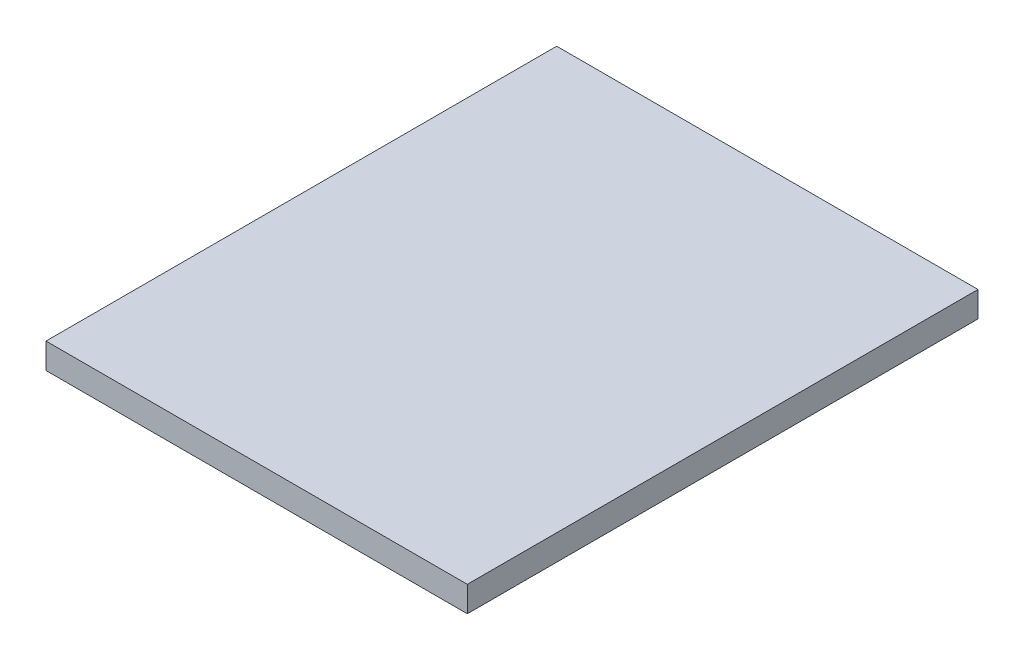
SolidWorks part; units mm, degrees
ref_plane "Front" through (0, 0, 0) normal (0, 0, 1) x (1, 0, 0)
ref_plane "Top" through (0, 0, 0) normal (0, 1, 0) x (1, 0, 0)
ref_plane "Right" through (0, 0, 0) normal (1, 0, 0) x (0, 0, -1)
sketch "Sketch1" plane through (0, 0, 0) normal (0, 1, 0) x (1, 0, 0)
  line L0 (33, 0) -> (0, 0) construction
  line L1 (0, 20) -> (33, 20)
  line L2 (0, 20) -> (0, -20)
  line L3 (0, -20) -> (33, -20)
  line L4 (33, 20) -> (33, -20)
  dimension "D1" = 33
  dimension "D2" = 40
extrude "Extrude1" add sketch "Sketch1" along normal blind 2
